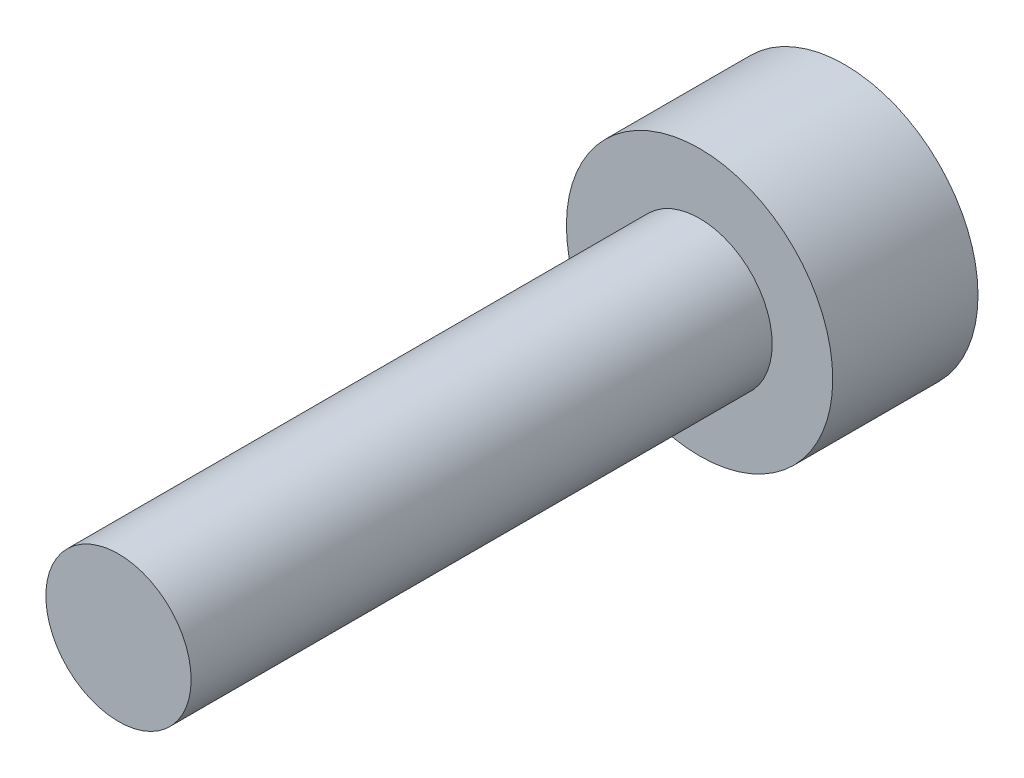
SolidWorks part; units mm, degrees
ref_plane "Front Plane" through (0, 0, 0) normal (0, 0, 1) x (1, 0, 0)
ref_plane "Top Plane" through (0, 0, 0) normal (0, 1, 0) x (1, 0, 0)
ref_plane "Right Plane" through (0, 0, 0) normal (1, 0, 0) x (0, 0, -1)
sketch "Sketch6" plane through (0, 0, 0) normal (1, 0, 0) x (0, 0, -1)
  line L0 (-12, 0) -> (22.525, 0) construction
  line L1 (3.025, 0) -> (-3.025, 0) construction
  line L2 (-12, 0) -> (-12, -1.5)
  line L3 (-12, -1.5) -> (0, -1.5)
  line L4 (0, 3.025) -> (0, -3.025) construction
  line L5 (0, -1.5) -> (0, -2.75)
  line L6 (0, -2.75) -> (3, -2.75)
  line L7 (3, -2.75) -> (3, 0)
  line L8 (3, 0) -> (-12, 0)
  dimension "L" = 12
  dimension "H" = 3
  dimension "A" = 5.5
  dimension "D" = 3
revolve "Revolve1" add sketch "Sketch6" angle 360 about L0
sketch "Sketch7" plane through (0, 0, -3) normal (0, 0, -1) x (-1, 0, 0)
  line L2 (-1.25, 0.7217) -> (-1.25, -0.7217)
  line L4 (-1.25, -0.7217) -> (0, -1.4434)
  line L5 (0, -1.4434) -> (1.25, -0.7217)
  line L6 (1.25, -0.7217) -> (1.25, 0.7217)
  line L7 (1.25, 0.7217) -> (0, 1.4434)
  line L8 (0, 1.4434) -> (-1.25, 0.7217)
  circle A0 centre (0, 0) radius 1.25 construction
  dimension "J" = 2.5
extrude "HEX" cut sketch "Sketch7" against normal blind 2.5
